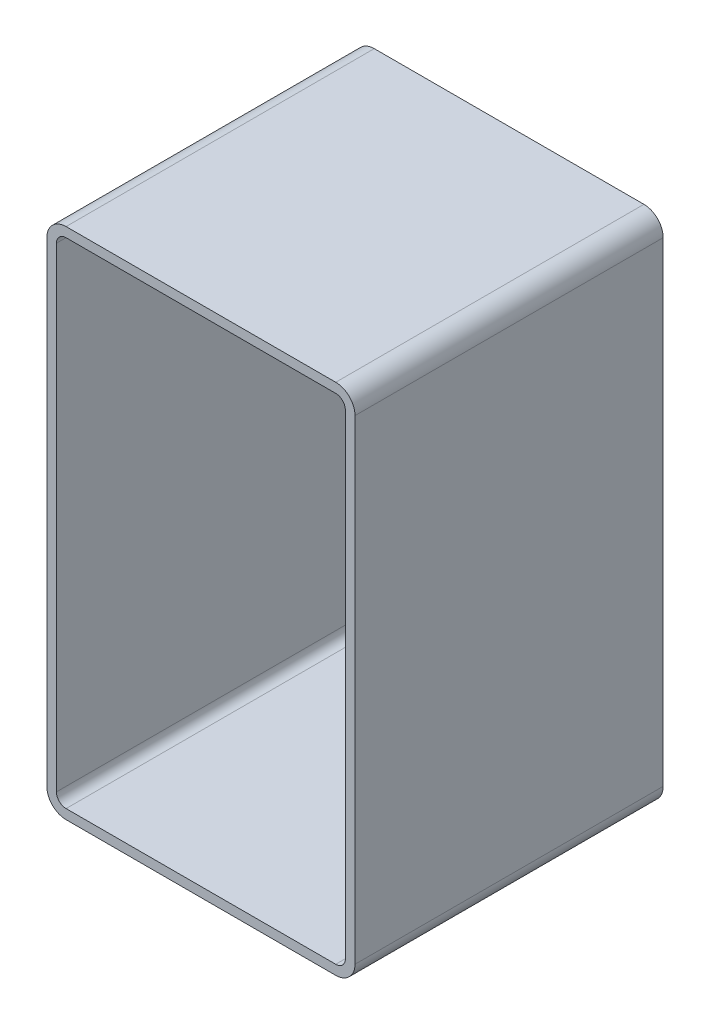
SolidWorks part; units mm, degrees
ref_plane "Front Plane" through (0, 0, 0) normal (0, 0, 1) x (1, 0, 0)
ref_plane "Top Plane" through (0, 0, 0) normal (0, 1, 0) x (1, 0, 0)
ref_plane "Right Plane" through (0, 0, 0) normal (1, 0, 0) x (0, 0, -1)
sketch "Sketch1" plane through (0, 0, 0) normal (0, 0, 1) x (1, 0, 0)
sketch_block_instance "HSS20x12x0.375-1"
sketch_block "HSS20x12x0.375"
extrude "Boss-Extrude1" add sketch "Sketch1" along normal blind 304.8
